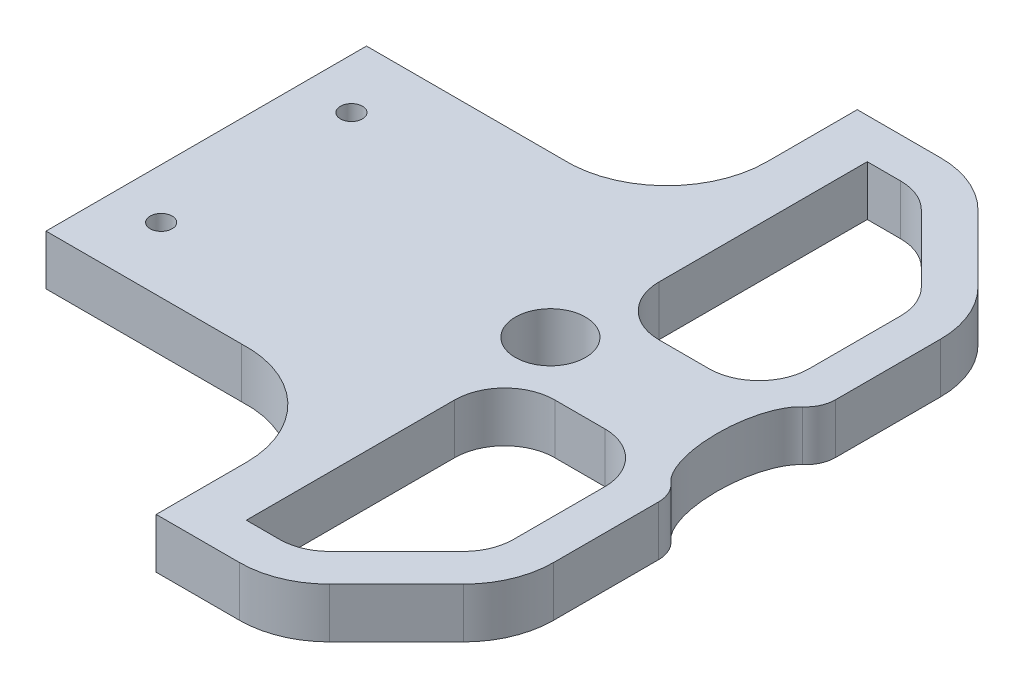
SolidWorks part; units mm, degrees
ref_plane "Plan de face" through (0, 0, 0) normal (0, 0, 1) x (1, 0, 0)
ref_plane "Plan de dessus" through (0, 0, 0) normal (0, 1, 0) x (1, 0, 0)
ref_plane "Plan de droite" through (0, 0, 0) normal (1, 0, 0) x (0, 0, -1)
sketch "Esquisse1" plane through (0, 0, 0) normal (0, 1, 0) x (1, 0, 0)
  line L0 (290, -21) -> (290, 21) construction
  line L1 (216.0616, 0) -> (391.1589, 0) construction
  line L2 (297.5, -31.2441) -> (297.5, 14.0824) construction
  line L4 (367.7991, 16) -> (226.8256, 16) construction
  line L8 (392.8893, 35) -> (288.1107, 35) construction
  line L10 (313, 42.5143) -> (313, 2.3285) construction
  line L11 (332, 42.5143) -> (332, -38.7194) construction
  line L12 (308, 25.9875) -> (308, 35)
  line L13 (308, 35) -> (316.3289, 35)
  line L14 (313, 31) -> (316.3289, 31)
  line L15 (322.6929, -32.364) -> (329.364, -25.6929)
  line L16 (308, -35) -> (316.3289, -35)
  line L17 (323, 5.2) -> (318, 5.2)
  line L18 (359.8468, -5.2) -> (234.3395, -5.2) construction
  line L19 (359.8468, 5.2) -> (233.3569, 5.2) construction
  line L20 (308, -25.9875) -> (308, -35)
  line L21 (328, 21.4) -> (328, 2.3285) construction
  line L22 (313, 10.2) -> (313, 31)
  line L23 (322.6929, 32.364) -> (329.364, 25.6929)
  line L24 (323, -5.2) -> (318, -5.2)
  line L25 (328, 10.2) -> (328, 19.3289)
  line L26 (278, -43.3353) -> (278, 41.1065) construction
  line L27 (328, -10.2) -> (328, -19.3289)
  line L29 (286, 9.5) -> (235.4626, 9.5) construction
  line L30 (283, 41.1065) -> (283, 5.2) construction
  line L31 (308, -43.3353) -> (308, 42.5143) construction
  line L32 (319.8645, 29.5355) -> (326.5355, 22.8645)
  line L33 (313, -10.2) -> (313, -31)
  line L34 (367.7991, 18) -> (321.4605, 18) construction
  line L35 (319.8645, -29.5355) -> (326.5355, -22.8645)
  line L36 (313, -31) -> (316.3289, -31)
  line L37 (332, 19.3289) -> (332, 8.8371)
  line L38 (359.8468, -7.2) -> (252.7085, -7.2) construction
  line L40 (278, 16) -> (278, -16)
  line L43 (332, -8.8371) -> (332, -19.3289)
  line L49 (278, 16) -> (297.5, 16)
  line L57 (278, -16) -> (297.5, -16)
  arc A2 (319.8645, 29.5355) -> (316.3289, 31) centre (316.3289, 26) ccw
  arc A3 (297.5, 16) -> (308, 25.9875) centre (298, 25.9875) ccw
  arc A4 (328, 19.3289) -> (326.5355, 22.8645) centre (323, 19.3289) ccw
  arc A5 (323, 5.2) -> (328, 10.2) centre (323, 10.2) ccw
  arc A6 (318, 5.2) -> (313, 10.2) centre (318, 10.2) cw
  arc A7 (322.6929, 32.364) -> (316.3289, 35) centre (316.3289, 26) ccw
  circle A8 centre (283, -9.5) radius 1.1
  circle A12 centre (283, 9.5) radius 1.1
  arc A16 (322.6929, -32.364) -> (316.3289, -35) centre (316.3289, -26) cw
  arc A17 (297.5, -16) -> (308, -25.9875) centre (298, -25.9875) cw
  arc A18 (318, -5.2) -> (313, -10.2) centre (318, -10.2) ccw
  arc A19 (323, -5.2) -> (328, -10.2) centre (323, -10.2) cw
  arc A22 (328, -19.3289) -> (326.5355, -22.8645) centre (323, -19.3289) cw
  arc A23 (319.8645, -29.5355) -> (316.3289, -31) centre (316.3289, -26) cw
  arc A24 (329.364, -25.6929) -> (332, -19.3289) centre (323, -19.3289) ccw
  arc A25 (329.364, 25.6929) -> (332, 19.3289) centre (323, 19.3289) cw
  arc A26 (330.9596, 6.5656) -> (332, 8.8371) centre (329, 8.8371) ccw
  arc A27 (330.9596, -6.5656) -> (332, -8.8371) centre (329, -8.8371) cw
  circle A28 centre (312.3645, 0) radius 3.5
  ellipse E1 centre (332, 0) end of major axis (332, -7) minor radius 3 (330.9596, 6.5656) -> (330.9596, -6.5656) ccw
  point P36 (328, 5.2)
  point P48 (313, 5.2)
  point P51 (320.0569, 35)
  point P56 (300.5, -16)
  point P59 (300.5, 16)
  point P136 (332, -23.0569)
  point P144 (332, 23.0569)
  dimension "D7" = 4
  dimension "D9" = 4
  dimension "D12" = 4
  dimension "D13" = 2
  dimension "D15" = 9
  dimension "D25" = 2
  dimension "D14" = 5.2
  dimension "D16" = 3
  dimension "D17" = 19.5
  dimension "D3" = 16
  dimension "D4" = 35
  dimension "D5" = 5
  dimension "D6" = 19
  dimension "D8" = 11.9431
  dimension "D10" = 12
  dimension "D11" = 9.5
  dimension "D19" = 5.2
  dimension "D21" = 30
extrude "Boss.-Extru.1" add sketch "Esquisse1" along normal blind 5
